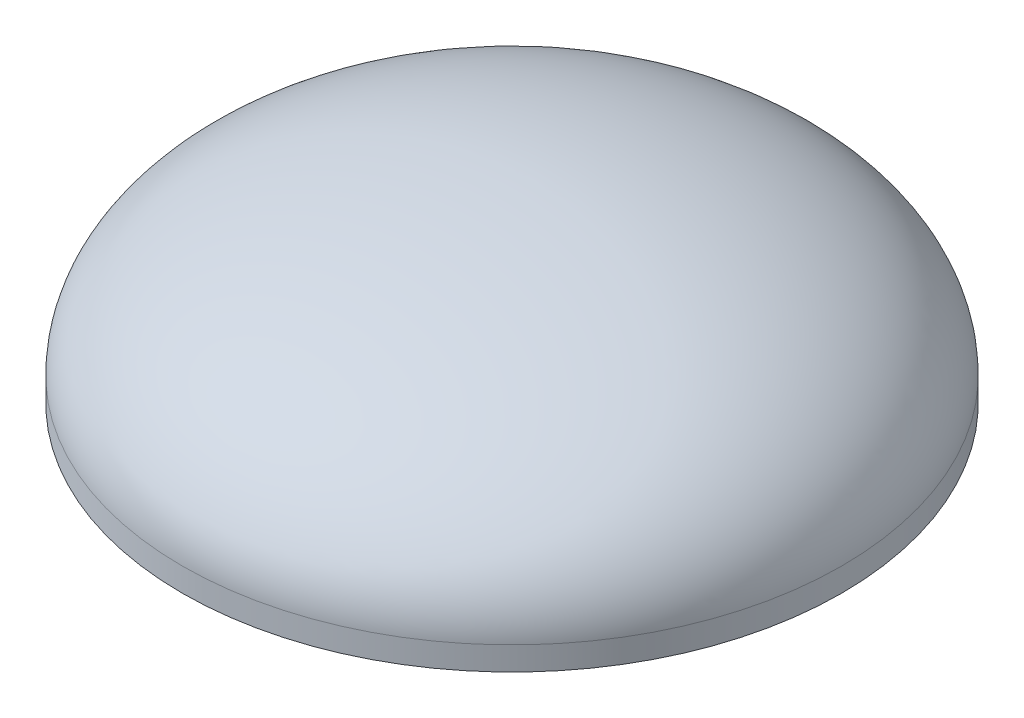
SolidWorks part; units mm, degrees
ref_plane "Right" through (0, 0, 0) normal (0, 0, 1) x (1, 0, 0)
ref_plane "Top" through (0, 0, 0) normal (0, 1, 0) x (1, 0, 0)
ref_plane "Front" through (0, 0, 0) normal (1, 0, 0) x (0, 0, -1)
sketch "Sketch1" plane through (0, 0, 0) normal (0, 0, 1) x (1, 0, 0)
  line L0 (-600, 0) -> (711.2, 0) construction
  line L1 (0, 355.6) -> (0, -262.0882) construction
  line L2 (711.2, 0) -> (711.2, -50.8)
  line L3 (711.2, -50.8) -> (0, -50.8)
  line L4 (0, -50.8) -> (0, 355.6)
  line L5 (0, 441.3239) -> (0, -172.0994) construction
  ellipse E0 centre (0, 0) end of major axis (-711.2, 0) minor radius 355.6 (711.2, 0) -> (0, 355.6) ccw
revolve "Revolve1" add sketch "Sketch1" angle 360 about L5
shell "Shell1" thickness 12.7
sketch "Sketch2" plane through (0, 0, 0) normal (0, 0, 1) x (1, 0, 0)
  line L0 (700.0875, -50.8) -> (711.2, -42.2731)
  line L1 (-711.2, -50.8) -> (711.2, -50.8) construction
  line L2 (711.2, -50.8) -> (711.2, 0) construction
  line L3 (711.2, -42.2731) -> (711.2, -50.8)
  line L4 (711.2, -50.8) -> (700.0875, -50.8)
  line L5 (0, 368.2765) -> (0, -140.1425) construction
  dimension "D1" = 1.5875
  dimension "D2" = 37.5
revolve "Cut-Revolve1" [suppressed] cut sketch "Sketch2" angle 360 about L5
ref_plane "Plane 1" through (0, 0, 0) normal (0.7071, 0, 0.7071) x (0.7071, 0, -0.7071)
equation "\"D2@Sketch1\" = \"D1@Sketch1@Shell 1<1>.Part@Vessel section 1<4>.Assembly\" / 2"
equation "\"D3@Sketch1\" = \"D2@Sketch1\"/2"
